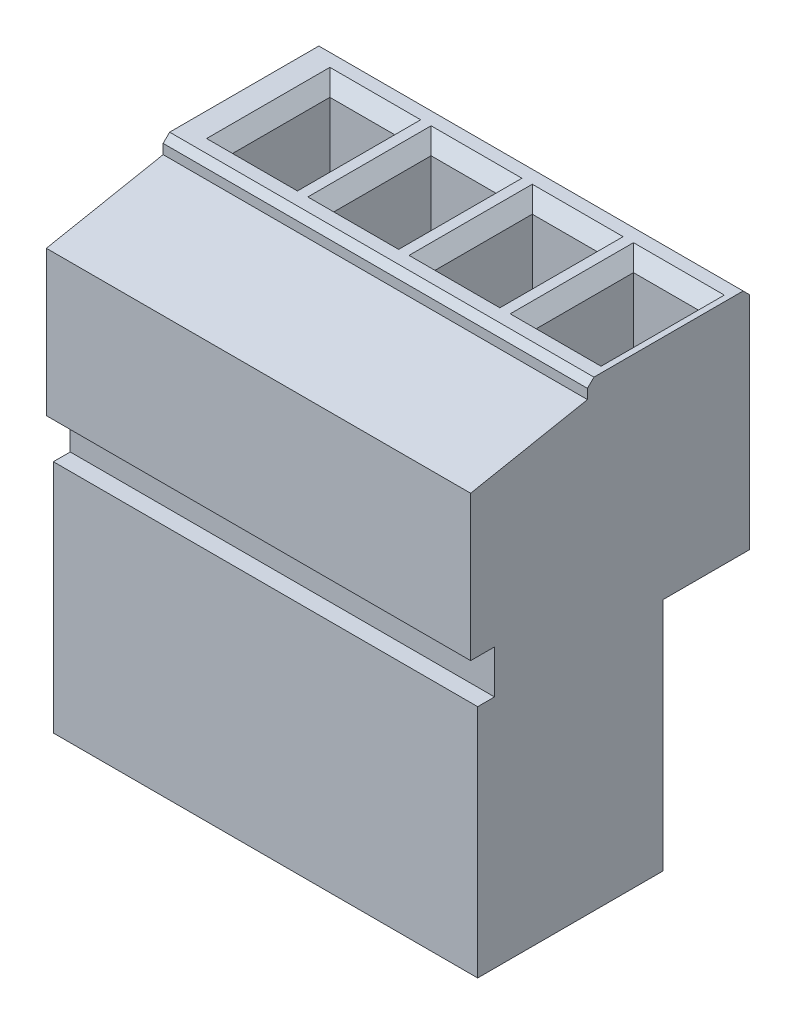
SolidWorks part; units mm, degrees
ref_plane "Front" through (0, 0, 0) normal (0, 0, 1) x (1, 0, 0)
ref_plane "Top" through (0, 0, 0) normal (0, 1, 0) x (1, 0, 0)
ref_plane "Right" through (0, 0, 0) normal (1, 0, 0) x (0, 0, -1)
sketch "Sketch1" plane through (0, 0, 0) normal (1, 0, 0) x (0, 0, -1)
  line L0 (0, 0) -> (7.2492, 0)
  line L1 (0, 0) -> (0, 9.1999)
  line L2 (7.2492, 0) -> (7.2492, 9.1999)
  line L3 (0, 9.1999) -> (0.6598, 9.1999)
  line L4 (4.2977, 18.0975) -> (10.6477, 18.0975)
  line L5 (10.6477, 18.0975) -> (10.6477, 9.1999)
  line L6 (-0.2743, 16.5735) -> (-0.2743, 10.8972)
  line L7 (4.2977, 18.0975) -> (4.2977, 17.4625)
  line L8 (4.2977, 17.4625) -> (-0.2743, 16.5735)
  line L9 (0.6598, 9.1999) -> (0.6598, 10.8972)
  line L10 (0.6598, 10.8972) -> (-0.2743, 10.8972)
  line L11 (7.2492, 9.1999) -> (10.6477, 9.1999)
  dimension "D1" = 7.2492
  dimension "D2" = 9.1999
  dimension "D3" = 18.0975
  dimension "D4" = 10.922
  dimension "D5" = 3.3985
  dimension "D6" = 0.635
  dimension "D7" = 0.889
  dimension "D8" = 6.35
extrude "Base-Extrude" add sketch "Sketch1" against normal blind 16.6116
sketch "Sketch2" plane through (0, 18.0975, 0) normal (0, 1, 0) x (-1, 0, 0)
  line L0 (-1.0238, -7.4727) -> (17.6354, -7.4727) construction
  line L1 (2.0066, -4.2977) -> (2.0066, -11.2413) construction
  line L2 (0, -10.6477) -> (0, -4.2977) construction
  line L3 (0.7366, -5.5677) -> (3.2766, -5.5677)
  line L4 (0.7366, -5.5677) -> (0.7366, -9.3777)
  line L5 (0.7366, -9.3777) -> (3.2766, -9.3777)
  line L6 (3.2766, -5.5677) -> (3.2766, -9.3777)
  line L7 (16.6116, -10.6477) -> (0, -10.6477) construction
  dimension "D1" = 2.0066
  dimension "D2" = 2.54
  dimension "D3" = 1.27
  dimension "D4" = 3.81
  dimension "D5" = 1.905
  dimension "D6" = 3.175
extrude "Cut-Extrude1" cut sketch "Sketch2" against normal blind 3.81
chamfer "Chamfer1" distance 0.508 angle 45
pattern_linear "LPattern1" count 4 spacing 3.9624
chamfer "Chamfer2" distance 0.254 angle 45
